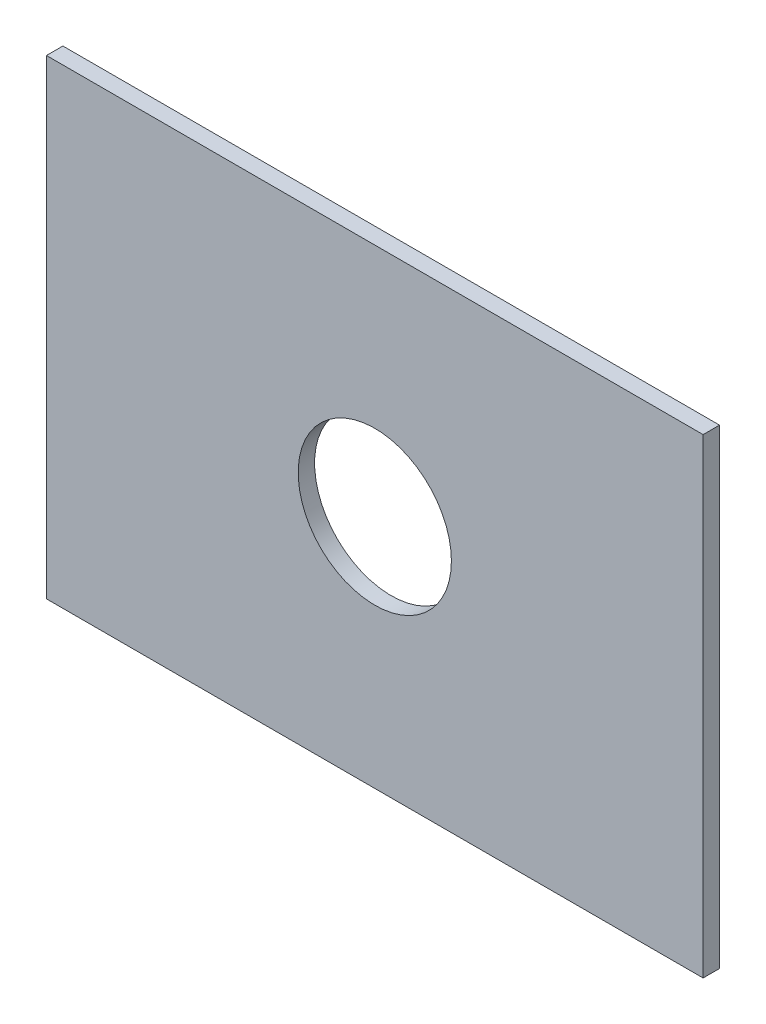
SolidWorks part; units mm, degrees
ref_plane "Alzado" through (0, 0, 0) normal (0, 0, 1) x (1, 0, 0)
ref_plane "Planta" through (0, 0, 0) normal (0, 1, 0) x (1, 0, 0)
ref_plane "Vista lateral" through (0, 0, 0) normal (1, 0, 0) x (0, 0, -1)
sketch "Croquis1" plane through (0, 0, 0) normal (0, 0, 1) x (1, 0, 0)
  line L1 (-300, 215) -> (300, 215)
  line L2 (-300, 215) -> (-300, -215)
  line L3 (-300, -215) -> (300, -215)
  line L4 (300, 215) -> (300, -215)
  line L5 (-300, 215) -> (300, -215) construction
  line L6 (-300, -215) -> (300, 215) construction
  point P1 (0, 0)
  dimension "D1" = 600
  dimension "D2" = 430
extrude "Saliente-Extruir1" add sketch "Croquis1" along normal blind 15
sketch "Croquis2" plane through (0, 0, 15) normal (0, 0, 1) x (1, 0, 0)
  circle A0 centre (0, 0) radius 70
  dimension "D1" = 140
extrude "Cortar-Extruir1" cut sketch "Croquis2" against normal blind 15
